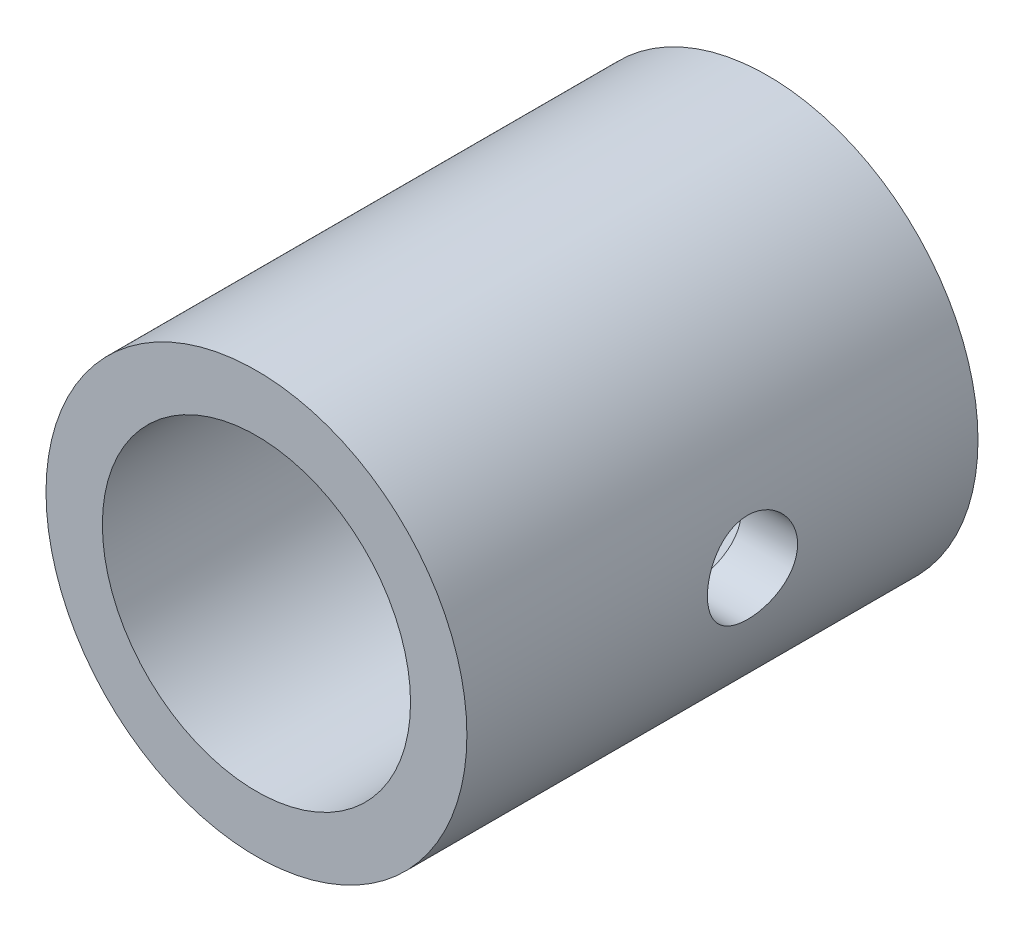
SolidWorks part; units mm, degrees
ref_plane "Face" through (0, 0, 0) normal (0, 0, 1) x (1, 0, 0)
ref_plane "Dessus" through (0, 0, 0) normal (0, 1, 0) x (1, 0, 0)
ref_plane "Droite" through (0, 0, 0) normal (1, 0, 0) x (0, 0, -1)
sketch "Esquisse1" plane through (0, 0, 0) normal (0, 0, 1) x (1, 0, 0)
  circle A0 centre (0, 0) radius 10.25
  circle A1 centre (0, 0) radius 14
  dimension "D1" = 20.5
  dimension "D2" = 28
extrude "Extrusion1" add sketch "Esquisse1" along normal blind 34
sketch "Esquisse2" plane through (0, 0, 0) normal (1, 0, 0) x (0, 0, -1)
  line L0 (-34, 0) -> (0, 0) construction
  line L1 (0, -14) -> (0, 14) construction
  circle A0 centre (-15, 0) radius 3
  dimension "D1" = 6
  dimension "D2" = 15
extrude "Enlèv. mat.-Extru.1" cut sketch "Esquisse2" against normal through all and the other way through all
